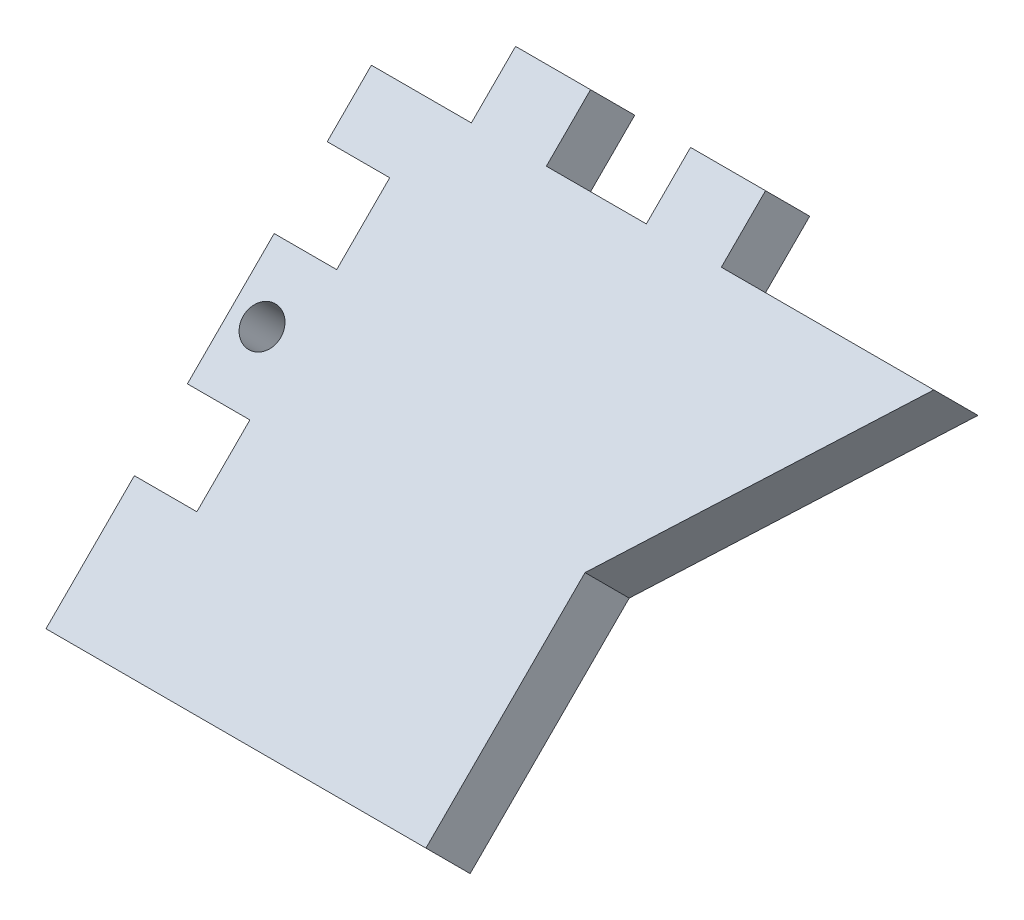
SolidWorks part; units mm, degrees
ref_plane "Front Plane" through (0, 0, 0) normal (0, 0, 1) x (1, 0, 0)
ref_plane "Top Plane" through (0, 0, 0) normal (0, 1, 0) x (1, 0, 0)
ref_plane "Right Plane" through (0, 0, 0) normal (1, 0, 0) x (0, 0, -1)
sketch "Sketch2" plane through (0, 0, 0) normal (1, 0, 0) x (0, 0, -1)
  line L0 (0, 0) -> (38.1, 0) construction
  line L1 (38.1, 0) -> (38.1, 38.1) construction
  line L2 (38.1, 38.1) -> (0, 0) construction
  dimension "D1" = 38.1
  dimension "D2" = 38.1
sketch "Sketch3" plane through (0, 0, 0) normal (0, 0, 1) x (1, 0, 0)
  line L0 (0, 0) -> (58.5606, 0) construction
ref_plane "Plane1" through (0, 0, 0) normal (0, 0.7071, 0.7071) x (1, 0, 0)
sketch "Sketch4" plane through (0, 0, 0) normal (0, 0.7071, 0.7071) x (1, 0, 0)
  line L0 (0, 0) -> (0, 53.1089)
  line L1 (0, 26.9408) -> (0, 53.8815) construction
  line L2 (0, 53.1089) -> (57.15, 53.1089)
  line L5 (0, 0) -> (58.5606, 0) construction
  line L6 (38.608, 0) -> (0, 0)
  line L7 (38.608, 0) -> (38.608, 22.86)
  line L9 (57.15, 53.1089) -> (57.15, 46.7589)
  line L10 (57.15, 46.7589) -> (38.608, 22.86)
  line L12 (0, 53.1089) -> (10.16, 53.1089)
  line L13 (0, 53.1089) -> (0, 46.7589)
  line L14 (0, 46.7589) -> (10.16, 46.7589)
  line L15 (10.16, 53.1089) -> (10.16, 46.7589)
  line L16 (17.78, 53.1089) -> (27.94, 53.1089)
  line L17 (17.78, 53.1089) -> (17.78, 46.7589)
  line L18 (17.78, 46.7589) -> (27.94, 46.7589)
  line L19 (27.94, 53.1089) -> (27.94, 46.7589)
  line L20 (35.56, 53.1089) -> (60.96, 53.1089)
  line L21 (35.56, 53.1089) -> (35.56, 46.7589)
  line L22 (35.56, 46.7589) -> (60.96, 46.7589)
  line L23 (60.96, 53.1089) -> (60.96, 46.7589)
  line L24 (0, 40.4114) -> (6.35, 40.4114)
  line L25 (0, 40.4114) -> (0, 32.7914)
  line L26 (0, 32.7914) -> (6.35, 32.7914)
  line L27 (6.35, 40.4114) -> (6.35, 32.7914)
  line L28 (0, 20.32) -> (6.35, 20.32)
  line L29 (0, 20.32) -> (0, 12.7)
  line L30 (0, 12.7) -> (6.35, 12.7)
  line L31 (6.35, 20.32) -> (6.35, 12.7)
  dimension "D1" = 53.1089
  dimension "D2" = 38.608
  dimension "D3" = 22.86
  dimension "D4" = 57.15
  dimension "D5" = 6.35
  dimension "D6" = 10.16
  dimension "D7" = 7.62
  dimension "D8" = 10.16
  dimension "D9" = 7.62
  dimension "D10" = 25.4
  dimension "D11" = 6.35
  dimension "D12" = 6.35
  dimension "D13" = 6.35
  dimension "D14" = 12.7
  dimension "D15" = 7.62
  dimension "D16" = 7.62
  dimension "D17" = 6.35
  dimension "D18" = 6.35
  dimension "D19" = 12.4714
extrude "Boss-Extrude5" add sketch "Sketch4" along normal blind 6.35 contours L28 L31 L30 L0 L6 L7 L10 L9 L2 L23 L22 L21 L19 L18 L17 L15 L14 L24 L27 L26
sketch "Sketch13" plane through (0, 4.4901, 4.4901) normal (0, 0.7071, 0.7071) x (1, 0, 0)
  line L0 (3.175, 32.7914) -> (3.175, 20.32) construction
  line L1 (0, 32.7914) -> (6.35, 32.7914) construction
  line L2 (0, 20.32) -> (6.35, 20.32) construction
  circle A0 centre (3.175, 26.5557) radius 1.905
  dimension "D1" = 3.81
extrude "Cut-Extrude5" cut sketch "Sketch13" against normal blind 6.35
